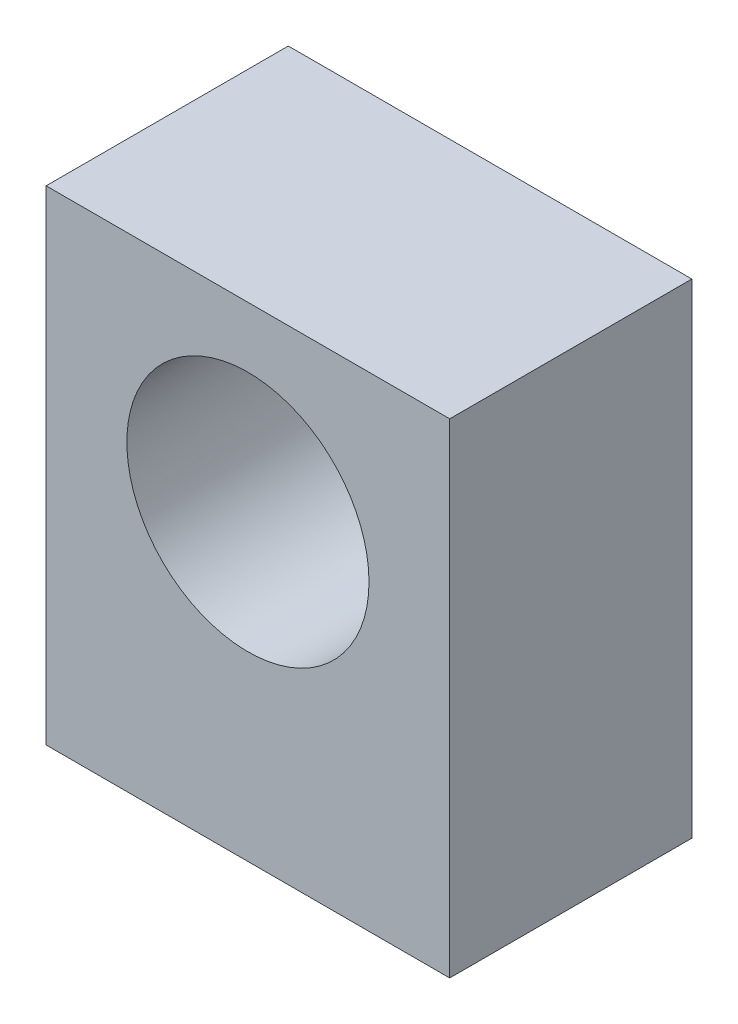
SolidWorks part; units mm, degrees
ref_plane "front" through (0, 0, 0) normal (0, 0, 1) x (1, 0, 0)
ref_plane "top" through (0, 0, 0) normal (0, 1, 0) x (1, 0, 0)
ref_plane "side" through (0, 0, 0) normal (1, 0, 0) x (0, 0, -1)
sketch "Sketch1" plane through (0, 0, 0) normal (0, 0, 1) x (1, 0, 0)
  line L0 (15.875, 0) -> (-15.875, 0)
  line L1 (15.875, 0) -> (15.875, 38.1)
  line L2 (-15.875, 38.1) -> (15.875, 38.1)
  line L3 (-15.875, 38.1) -> (-15.875, 0)
  line L4 (0, 0) -> (0, 38.1) construction
  dimension "D1" = 31.75
  dimension "D2" = 38.1
extrude "Base-Extrude" add sketch "Sketch1" along normal blind 19.05
sketch "Sketch2" plane through (0, 0, 19.05) normal (0, 0, 1) x (1, 0, 0)
  line L0 (0, 0) -> (0, 23.8125) construction
  line L1 (15.875, 0) -> (-15.875, 0) construction
  circle A0 centre (0, 23.8125) radius 9.525
  dimension "D1" = 19.05
  dimension "D2" = 23.8125
extrude "Cut-Extrude1" cut sketch "Sketch2" against normal through all
